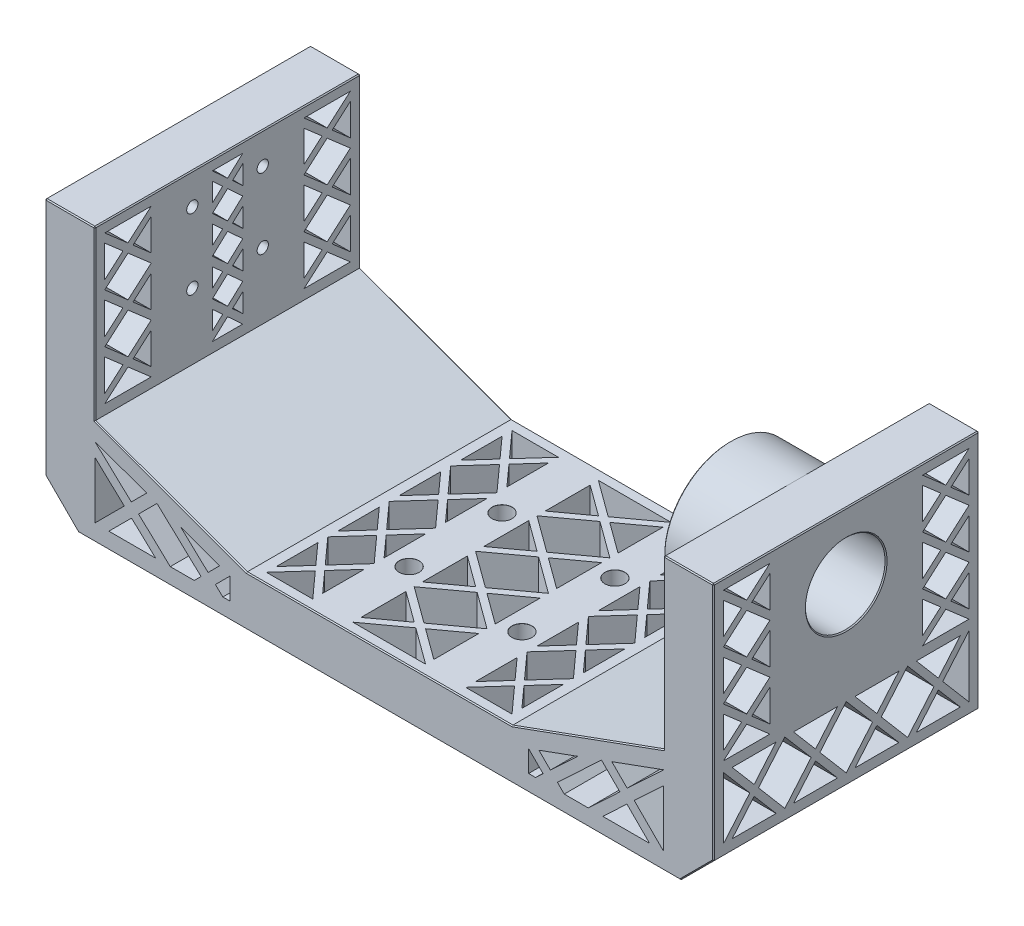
SolidWorks part; units mm, degrees
ref_plane "前视基准面" through (0, 0, 0) normal (0, 0, 1) x (1, 0, 0)
ref_plane "上视基准面" through (0, 0, 0) normal (0, 1, 0) x (1, 0, 0)
ref_plane "右视基准面" through (0, 0, 0) normal (1, 0, 0) x (0, 0, -1)
other "Configuration Table"
sketch "草图1" plane through (0, 0, 0) normal (0, 0, 1) x (1, 0, 0)
  line L0 (40, 0) -> (-40, 0)
  line L1 (-40, 0) -> (-85.7, 16.6334)
  line L2 (-85.7, 16.6334) -> (-85.7, 67.1815)
  line L3 (0, 0) -> (0, 67.1815) construction
  line L4 (85.7, 16.6334) -> (85.7, 67.1815)
  line L5 (40, 0) -> (85.7, 16.6334)
  dimension "D1" = 80
  dimension "D2" = 171.4
  dimension "D3" = 160
extrude "拉伸-薄壁1" add sketch "草图1" along normal mid plane 80 thin
hole_wizard "M3 六角圆柱头螺钉的柱形沉头孔1" positions "草图2" profile "草图3" counterbore size "M3" standard "GB"
sketch "草图2" plane through (0, 0, 0) normal (0, 1, 0) x (1, 0, 0)
  line L1 (17, -14) -> (-17, -14)
  line L2 (17, -14) -> (17, 14)
  line L3 (17, 14) -> (-17, 14)
  line L4 (-17, -14) -> (-17, 14)
  line L5 (17, -14) -> (-17, 14) construction
  line L6 (17, 14) -> (-17, -14) construction
  point P1 (0, 0)
  dimension "D1" = 34
  dimension "D2" = 28
sketch "草图3" plane through (-17, 0, 14) normal (1, 0, 0) x (0, 0, 1)
  line L0 (0, 0) -> (0, 15)
  line L1 (0, 15) -> (1.7, 15)
  line L3 (1.7, 15) -> (1.7, 9)
  line L4 (3, 9) -> (1.7, 9)
  line L5 (3, 9) -> (3, 0.025)
  line L6 (3, 0.025) -> (3.025, 0)
  line L7 (3.025, 0) -> (0, 0)
  line L8 (-3, 0.025) -> (-3.025, 0) construction
  line L11 (0, -6.35) -> (0, 107.95) construction
  dimension "通孔孔直径" = 3.4
  dimension "通孔孔深度" = 15
  dimension "柱形沉头孔直径" = 6
  dimension "柱形沉头孔深度" = 9
  dimension "近端锥形沉头孔直径" = 6.05
  dimension "近端锥形沉头孔角度" = 90
hole_wizard "M3 六角圆柱头螺钉的柱形沉头孔2" positions "草图4" profile "草图5" counterbore size "M3" standard "GB"
sketch "草图4" plane through (-100.7, 0, 0) normal (-1, 0, 0) x (0, 0, 1)
  line L0 (40, 67.1815) -> (-40, 67.1815) construction
  line L2 (10.6066, 36.5749) -> (-10.6066, 36.5749)
  line L3 (10.6066, 36.5749) -> (10.6066, 57.7881)
  line L4 (10.6066, 57.7881) -> (-10.6066, 57.7881)
  line L5 (-10.6066, 36.5749) -> (-10.6066, 57.7881)
  line L6 (10.6066, 36.5749) -> (-10.6066, 57.7881) construction
  line L7 (10.6066, 57.7881) -> (-10.6066, 36.5749) construction
  circle A0 centre (0, 47.1815) radius 15 construction
  dimension "D1" = 30
  dimension "D2" = 20
sketch "草图5" plane through (-100.7, 36.5749, -10.6066) normal (0, 1, 0) x (0, 0, 1)
  line L0 (0, 0) -> (0, 15)
  line L1 (0, 15) -> (1.7, 15)
  line L3 (1.7, 15) -> (1.7, 9)
  line L4 (3, 9) -> (1.7, 9)
  line L5 (3, 9) -> (3, 0.025)
  line L6 (3, 0.025) -> (3.025, 0)
  line L7 (3.025, 0) -> (0, 0)
  line L8 (-3, 0.025) -> (-3.025, 0) construction
  line L11 (0, -6.35) -> (0, 107.95) construction
  dimension "通孔孔直径" = 3.4
  dimension "通孔孔深度" = 15
  dimension "柱形沉头孔直径" = 6
  dimension "柱形沉头孔深度" = 9
  dimension "近端锥形沉头孔直径" = 6.05
  dimension "近端锥形沉头孔角度" = 90
sketch "草图6" plane through (85.7, 0, 0) normal (-1, 0, 0) x (0, 0, 1)
  line L0 (40, 67.1815) -> (-40, 67.1815) construction
  circle A0 centre (0, 47.1815) radius 20
  dimension "D1" = 20
  dimension "D2" = 40
extrude "凸台-拉伸1" add sketch "草图6" along normal blind 20
sketch "草图7" plane through (65.7, 0, 0) normal (-1, 0, 0) x (0, 0, 1)
  circle A0 centre (0, 47.1815) radius 16.25
  dimension "D1" = 32.5
extrude "切除-拉伸1" cut sketch "草图7" against normal blind 7
sketch "草图8" plane through (100.7, 0, 0) normal (1, 0, 0) x (0, 0, -1)
  circle A0 centre (0, 47.1815) radius 12
  dimension "D1" = 24
extrude "切除-拉伸2" cut sketch "草图8" against normal up to next
sketch "草图9" plane through (0, 0, 40) normal (0, 0, 1) x (1, 0, 0)
  line L0 (-100.7, 6.1303) -> (-42.6449, -15)
  line L1 (-42.6449, -15) -> (-100.7, -15)
  line L2 (-100.7, -15) -> (-100.7, 6.1303)
  line L3 (42.6449, -15) -> (100.7, 6.1303)
  line L4 (100.7, 6.1303) -> (100.7, -15)
  line L5 (100.7, -15) -> (42.6449, -15)
extrude "凸台-拉伸2" add sketch "草图9" against normal up to surface (80 mm away)
chamfer "倒角1" distance 10 angle 45 2 edges at (-100.7, -15, 0) (100.7, -15, 0)
chamfer "倒角2" distance 0.3 angle 45 32 edges at (85.7, 67.1815, -20) (65.7, 47.1815, 20) (-100.7, 31.0907, -40) (-93.2, 67.1815, -40) (65.7, 47.1815, 16.25) (-85.7, 41.9075, -40) (100.7, 47.1815, -12) (-62.85, 8.3167, -40) (0, 0, -40) (85.7, 41.9075, 40) (62.85, 8.3167, -40) (85.7, 41.9075, -40) (93.2, 67.1815, -40) (100.7, 31.0907, 40) (0, -15, 40) (95.7, -10, 40) (-95.7, -10, 40) (0, -15, -40) (100.7, 31.0907, -40) (95.7, -10, -40) (-95.7, -10, -40) (62.85, 8.3167, 40) (-100.7, 67.1815, 0) (-85.7, 67.1815, 0) (85.7, 67.1815, 20) (100.7, 67.1815, 0) (0, 0, 40) (-62.85, 8.3167, 40) (-85.7, 41.9075, 40) (-93.2, 67.1815, 40) (-100.7, 31.0907, 40) (93.2, 67.1815, 40)
sketch "草图11" plane through (0, 0, -40) normal (0, 0, -1) x (-1, 0, 0)
  line L0 (-85.7, 11.3126) -> (-45, -3.501)
  line L1 (-45, -3.501) -> (-45, -10)
  line L2 (-45, -10) -> (-85.7, -10)
  line L3 (-85.7, -10) -> (-85.7, 11.3126)
  line L4 (-85.7, 16.6334) -> (-40, 0) construction
  line L5 (90.7, -15) -> (-90.7, -15) construction
  line L7 (-85.7, 66.8815) -> (-85.7, 16.6334) construction
  dimension "D1" = 5
  dimension "D2" = 5
  dimension "D3" = 5
extrude "切除-拉伸4" cut sketch "草图11" against normal up to next
sketch "草图12" plane through (0, 0, -40) normal (0, 0, -1) x (-1, 0, 0)
  line L0 (-85.7, -10) -> (-70.0746, 5.6254)
  line L1 (-45, -3.501) -> (-85.7, 11.3126) construction
  line L3 (-66.9641, 4.4932) -> (-81.4574, -10)
  line L4 (-85.7, -10) -> (-45, -10) construction
  line L5 (-81.4574, -10) -> (-85.7, -10)
  line L6 (-85.7, 11.3126) -> (-85.7, 7.2011)
  line L7 (-85.7, 11.3126) -> (-85.7, -10) construction
  line L8 (-85.7, 7.2011) -> (-67.3454, -10)
  line L10 (-62.9582, -10) -> (-85.7, 11.3126)
  line L11 (-67.3454, -10) -> (-62.9582, -10)
  line L12 (-45, -3.501) -> (-51.499, -10)
  line L16 (-59.7911, 1.8825) -> (-47.1118, -10)
  line L17 (-51.499, -10) -> (-66.9641, 4.4932)
  line L18 (-66.9641, 4.4932) -> (-59.7911, 1.8825)
  line L21 (-70.0746, 5.6254) -> (-59.7911, 1.8825)
  line L22 (-45, -3.501) -> (-48.1105, -2.3689)
  line L23 (-48.1105, -2.3689) -> (-55.7416, -10)
  line L24 (-55.7416, -10) -> (-51.499, -10)
  line L25 (-47.1118, -10) -> (-51.499, -10)
  point P17 (-58.7685, -10)
  point P24 (-67.2593, 4.6007)
  point P25 (-56.128, -10.0626)
  dimension "D1" = 3
  dimension "D2" = 3
  dimension "D3" = 3
  dimension "D4" = 45
  dimension "D5" = 3
extrude "凸台-拉伸3" add sketch "草图12" against normal up to surface (80 mm away) contours L10 L3 L0 M14 | L3 L10 L0 L8 | L0 L10 L8 M13 | L8 L0 L3 M16 | L10 L3 L8 M16 | L23 L16 L17 M14 | L23 L16 L12 M14 | L16 L23 L17 L12 | L17 L23 M16 | L16 L12 M16
mirror "镜向1" about plane through (0, 0, 0) normal (1, 0, 0) of "切除-拉伸4", "凸台-拉伸3"
sketch "草图14" plane through (-85.7, 0, 0) normal (1, 0, 0) x (0, 0, -1)
  line L0 (39.7, 67.1815) -> (-39.7, 67.1815) construction
  line L1 (23, 19.6334) -> (37, 19.6334)
  line L2 (23, 19.6334) -> (23, 64.1815)
  line L3 (23, 64.1815) -> (37, 64.1815)
  line L4 (37, 19.6334) -> (37, 64.1815)
  line L5 (23, 19.6334) -> (37, 64.1815) construction
  line L6 (23, 64.1815) -> (37, 19.6334) construction
  line L7 (40, -4.8757) -> (40, 66.8815) construction
  line L8 (-39.7, 16.6334) -> (39.7, 16.6334) construction
  circle A1 centre (0, 47.1815) radius 20 construction
  point P0 (30, 41.9075)
  dimension "D1" = 3
  dimension "D2" = 3
  dimension "D3" = 3
  dimension "D4" = 3
extrude "切除-拉伸5" cut sketch "草图14" against normal blind 15
sketch "草图15" plane through (-100.7, 0, 0) normal (-1, 0, 0) x (0, 0, 1)
  line L1 (-37, 34.4828) -> (-37, 31.8302)
  line L4 (-37, 31.8302) -> (-23, 19.6334)
  line L8 (-23, 19.6334) -> (-23, 22.286)
  line L28 (-23, 19.6334) -> (-23, 64.1815) construction
  line L32 (-37, 49.3321) -> (-23, 61.5289)
  line L35 (-37, 64.1815) -> (-37, 19.6334) construction
  line L55 (-37, 49.3321) -> (-37, 46.6796)
  line L56 (-37, 46.6796) -> (-23, 34.4828)
  line L57 (-23, 34.4828) -> (-23, 37.1353)
  line L58 (-23, 37.1353) -> (-37, 49.3321)
  line L59 (-23, 49.3321) -> (-23, 46.6796)
  line L60 (-23, 46.6796) -> (-37, 34.4828)
  line L61 (-37, 34.4828) -> (-37, 37.1353)
  line L62 (-37, 37.1353) -> (-23, 49.3321)
  line L63 (-23, 22.286) -> (-37, 34.4828)
  line L64 (-23, 34.4828) -> (-37, 22.286)
  line L65 (-37, 22.286) -> (-37, 19.6334)
  line L66 (-37, 19.6334) -> (-23, 31.8302)
  line L67 (-23, 31.8302) -> (-23, 34.4828)
  line L68 (-23, 61.5289) -> (-23, 64.1815)
  line L69 (-23, 64.1815) -> (-37, 51.9847)
  line L70 (-37, 51.9847) -> (-37, 49.3321)
  line L71 (-23, 49.3321) -> (-37, 61.5289)
  line L72 (-37, 61.5289) -> (-37, 64.1815)
  line L73 (-37, 64.1815) -> (-23, 51.9847)
  line L74 (-23, 51.9847) -> (-23, 49.3321)
  point P7 (-23, 30.8308)
  point P16 (-37, 62.6154)
  point P27 (-37, 61.5289)
  point P28 (-23, 58.7965)
  dimension "D1" = 2
  dimension "D2" = 2
  dimension "D3" = 2
  dimension "D4" = 2
  dimension "D5" = 2
extrude "凸台-拉伸4" add sketch "草图15" against normal blind 15 contours L73 L71 L69 M31 | L73 L69 L71 L32 | L69 L73 L32 M33 | L32 L71 L69 M31 | L73 L32 L71 M33 | L62 L58 L60 M33 | L56 L62 L58 M31 | L62 L56 L60 L58 | L62 L60 L56 M31 | L58 L60 L56 M33 | L63 L66 L64 M33 | L64 L63 L4 M31 | L4 L66 L63 L64 | L66 L4 L63 M33 | L66 L4 L64 M31
mirror "镜向5" about plane through (0, 0, 0) normal (1, 0, 0) of "切除-拉伸5", "凸台-拉伸4"
sketch "草图16" plane through (-100.7, 0, 0) normal (-1, 0, 0) x (0, 0, 1)
  line L0 (-39.7, 67.1815) -> (39.7, 67.1815) construction
  line L1 (4.5816, 19.6334) -> (-4.5816, 19.6334)
  line L2 (4.5816, 19.6334) -> (4.5816, 64.1815)
  line L3 (4.5816, 64.1815) -> (-4.5816, 64.1815)
  line L4 (-4.5816, 19.6334) -> (-4.5816, 64.1815)
  line L5 (4.5816, 19.6334) -> (-4.5816, 64.1815) construction
  line L6 (4.5816, 64.1815) -> (-4.5816, 19.6334) construction
  line L7 (39.7, 16.6334) -> (-39.7, 16.6334) construction
  circle A1 centre (10.6066, 57.7881) radius 3.025 construction
  circle A2 centre (-10.6066, 57.7881) radius 3.025 construction
  point P0 (0, 41.9075)
  point P5 (0, 44.013)
  dimension "D1" = 3
  dimension "D2" = 3
  dimension "D3" = 3
  dimension "D4" = 3
extrude "切除-拉伸6" cut sketch "草图16" against normal up to next
sketch "草图17" plane through (-100.7, 0, 0) normal (-1, 0, 0) x (0, 0, 1)
  line L34 (-4.5816, 64.1815) -> (-4.5816, 61.4652)
  line L35 (-4.5816, 64.1815) -> (-4.5816, 19.6334) construction
  line L36 (-4.5816, 61.4652) -> (4.5816, 53.0445)
  line L37 (4.5816, 19.6334) -> (4.5816, 64.1815) construction
  line L38 (4.5816, 53.0445) -> (4.5816, 55.7607)
  line L39 (4.5816, 55.7607) -> (-4.5816, 64.1815)
  line L40 (4.5816, 64.1815) -> (4.5816, 61.4652)
  line L41 (4.5816, 61.4652) -> (-4.5816, 53.0445)
  line L42 (-4.5816, 53.0445) -> (-4.5816, 55.7607)
  line L43 (-4.5816, 55.7607) -> (4.5816, 64.1815)
  line L44 (-4.5816, 53.0445) -> (4.5816, 44.6237)
  line L45 (4.5816, 44.6237) -> (4.5816, 41.9075)
  line L46 (4.5816, 41.9075) -> (-4.5816, 50.3282)
  line L47 (-4.5816, 50.3282) -> (-4.5816, 53.0445)
  line L48 (4.5816, 53.0445) -> (-4.5816, 44.6237)
  line L49 (-4.5816, 44.6237) -> (-4.5816, 41.9075)
  line L50 (-4.5816, 41.9075) -> (4.5816, 50.3282)
  line L51 (4.5816, 50.3282) -> (4.5816, 53.0445)
  line L52 (-4.5816, 41.9075) -> (4.5816, 33.4867)
  line L53 (4.5816, 33.4867) -> (4.5816, 30.7704)
  line L54 (4.5816, 30.7704) -> (-4.5816, 39.1912)
  line L55 (-4.5816, 39.1912) -> (-4.5816, 41.9075)
  line L56 (4.5816, 41.9075) -> (-4.5816, 33.4867)
  line L57 (-4.5816, 33.4867) -> (-4.5816, 30.7704)
  line L58 (-4.5816, 30.7704) -> (4.5816, 39.1912)
  line L59 (4.5816, 39.1912) -> (4.5816, 41.9075)
  line L60 (-4.5816, 30.7704) -> (4.5816, 22.3497)
  line L61 (4.5816, 22.3497) -> (4.5816, 19.6334)
  line L62 (4.5816, 19.6334) -> (-4.5816, 28.0542)
  line L63 (-4.5816, 28.0542) -> (-4.5816, 30.7704)
  line L64 (4.5816, 30.7704) -> (-4.5816, 22.3497)
  line L65 (-4.5816, 22.3497) -> (-4.5816, 19.6334)
  line L66 (-4.5816, 19.6334) -> (4.5816, 28.0542)
  line L67 (4.5816, 28.0542) -> (4.5816, 30.7704)
  point P12 (-4.5816, 24.5438)
  point P35 (-4.5816, 29.9561)
  point P36 (-4.5816, 23.0884)
  point P37 (4.5816, 44.6237)
  dimension "D1" = 2
  dimension "D2" = 2
  dimension "D3" = 2
  dimension "D4" = 2
  dimension "D5" = 2
  dimension "D6" = 2
  dimension "D7" = 2
extrude "凸台-拉伸5" add sketch "草图17" against normal blind 15 contours L66 L62 L61 L60 | L65 L66 L62 L64 | L62 L66 L60 L64 | L64 L60 L63 L62 | L66 L67 L64 L60 | L57 L58 L54 L56 | L58 L54 L53 L52 | L54 L58 L52 L56 | L56 L52 L55 L54 | L58 L59 L56 L52 | L49 L50 L46 L48 | L46 L50 L44 L48 | L50 L46 L45 L44 | L50 L51 L48 L44 | L48 L44 L47 L46 | L39 L41 L36 L38 | L43 L36 L41 L39 | L43 L42 L41 L36 | L36 L43 L39 L34 | L43 L39 L41 L40
sketch "草图18" plane through (0, 0, 0) normal (0, 1, 0) x (1, 0, 0)
  line L0 (-40.0529, 40) -> (40.0529, 40) construction
  line L1 (10.975, -37) -> (-10.975, -37)
  line L2 (10.975, -37) -> (10.975, 37)
  line L3 (10.975, 37) -> (-10.975, 37)
  line L4 (-10.975, -37) -> (-10.975, 37)
  line L5 (10.975, -37) -> (-10.975, 37) construction
  line L6 (10.975, 37) -> (-10.975, -37) construction
  circle A5 centre (-17, 14) radius 3.025 construction
  point P0 (0, 0)
  dimension "D1" = 3
  dimension "D2" = 3
extrude "切除-拉伸7" cut sketch "草图18" against normal up to next
sketch "草图19" plane through (0, 0, 0) normal (0, 1, 0) x (1, 0, 0)
  line L0 (-10.975, 37) -> (-10.975, 34.5238)
  line L1 (-10.975, 37) -> (-10.975, -37) construction
  line L2 (-10.975, 34.5238) -> (10.975, 18.5)
  line L3 (10.975, -37) -> (10.975, 37) construction
  line L4 (10.975, 18.5) -> (10.975, 20.9762)
  line L5 (10.975, 20.9762) -> (-10.975, 37)
  line L6 (10.975, 37) -> (10.975, 34.5238)
  line L7 (10.975, 34.5238) -> (-10.975, 18.5)
  line L8 (-10.975, 18.5) -> (-10.975, 20.9762)
  line L9 (-10.975, 20.9762) -> (10.975, 37)
  line L10 (-10.975, 18.5) -> (-10.975, 16.0238)
  line L11 (-10.975, 16.0238) -> (10.975, 0)
  line L12 (10.975, 0) -> (10.975, 2.4762)
  line L13 (10.975, 2.4762) -> (-10.975, 18.5)
  line L14 (10.975, 18.5) -> (10.975, 16.0238)
  line L15 (10.975, 16.0238) -> (-10.975, 0)
  line L16 (-10.975, 0) -> (-10.975, 2.4762)
  line L17 (-10.975, 2.4762) -> (10.975, 18.5)
  point P12 (0, 0)
  dimension "D1" = 2
  dimension "D2" = 2
  dimension "D3" = 2
  dimension "D4" = 2
extrude "凸台-拉伸6" add sketch "草图19" against normal up to surface (15 mm away) contours L9 L5 L7 M11 | L9 L7 L2 M9 | L11 L17 L13 M9 | L17 L13 L15 M11 | L17 L11 L15 L13 | L17 L15 L11 M9 | L13 L15 L11 M11 | L5 L7 L2 M11 | L9 L2 L7 L5 | L2 L9 L5 M9
mirror "镜向8" about plane through (0, 0, 0) normal (0, 0, 1) of "凸台-拉伸6"
sketch "草图20" plane through (0, 0, 0) normal (0, 1, 0) x (1, 0, 0)
  line L0 (-40.0529, 40) -> (40.0529, 40) construction
  line L1 (-23.025, -37) -> (-37, -37)
  line L2 (-23.025, -37) -> (-23.025, 37)
  line L3 (-23.025, 37) -> (-37, 37)
  line L4 (-37, -37) -> (-37, 37)
  line L5 (-23.025, -37) -> (-37, 37) construction
  line L6 (-23.025, 37) -> (-37, -37) construction
  line L7 (-40, -39.7) -> (-40, 39.7) construction
  circle A1 centre (-17, 14) radius 3.025 construction
  point P0 (-30.0125, 0)
  point P5 (0, 0)
  dimension "D1" = 3
  dimension "D2" = 3
  dimension "D3" = 3
extrude "切除-拉伸8" cut sketch "草图20" against normal up to next
sketch "草图21" plane through (0, 0, 0) normal (0, 1, 0) x (1, 0, 0)
  line L0 (-37, 37) -> (-37, 34.012)
  line L1 (-37, 37) -> (-37, -37) construction
  line L2 (-37, 34.012) -> (-23.025, 18.5)
  line L3 (-23.025, -37) -> (-23.025, 37) construction
  line L4 (-23.025, 18.5) -> (-23.025, 21.488)
  line L5 (-23.025, 21.488) -> (-37, 37)
  line L6 (-23.025, 37) -> (-23.025, 34.012)
  line L7 (-23.025, 34.012) -> (-37, 18.5)
  line L8 (-37, 18.5) -> (-37, 21.488)
  line L9 (-37, 21.488) -> (-23.025, 37)
  line L10 (-37, 18.5) -> (-37, 15.512)
  line L11 (-37, 15.512) -> (-23.025, 0)
  line L12 (-23.025, 0) -> (-23.025, 2.988)
  line L13 (-23.025, 2.988) -> (-37, 18.5)
  line L14 (-23.025, 18.5) -> (-23.025, 15.512)
  line L15 (-23.025, 15.512) -> (-37, 0)
  line L16 (-37, 0) -> (-37, 2.988)
  line L17 (-37, 2.988) -> (-23.025, 18.5)
  point P17 (-23.025, 2.295)
  dimension "D1" = 2
  dimension "D2" = 2
  dimension "D3" = 2
  dimension "D4" = 2
extrude "凸台-拉伸7" add sketch "草图21" against normal up to surface (15 mm away) contours L2 L9 L5 L0 | L9 L2 L7 L5 | L9 L5 L7 L6 | L5 L7 L2 L4 | L9 L8 L7 L2 | L11 L17 L13 L10 | L17 L11 L15 L13 | L17 L13 L15 L14 | L13 L15 L11 L12 | L17 L16 L15 L11
mirror "镜向9" about plane through (0, 0, 0) normal (0, 0, 1) of "凸台-拉伸7"
mirror "镜向10" about plane through (0, 0, 0) normal (1, 0, 0) of "镜向9", "切除-拉伸8", "凸台-拉伸7"
sketch "草图22" plane through (100.7, 0, 0) normal (1, 0, 0) x (0, 0, -1)
  line L0 (40, 66.8815) -> (40, -4.8757) construction
  line L1 (37, -2) -> (-37, -2)
  line L2 (37, -2) -> (37, 16.6334)
  line L3 (37, 16.6334) -> (-37, 16.6334)
  line L4 (-37, -2) -> (-37, 16.6334)
  line L5 (37, -2) -> (-37, 16.6334) construction
  line L6 (37, 16.6334) -> (-37, -2) construction
  line L7 (-39.7, -5) -> (39.7, -5) construction
  line L8 (23, 19.6334) -> (37, 19.6334) construction
  point P0 (0, 7.3167)
  point P5 (0, 0)
  dimension "D1" = 3
  dimension "D2" = 3
  dimension "D3" = 3
extrude "切除-拉伸9" cut sketch "草图22" against normal blind 10
sketch "草图23" plane through (90.7, 0, 0) normal (1, 0, 0) x (0, 0, -1)
  line L1 (37, 16.6334) -> (-37, 16.6334) construction
  line L2 (-34.3727, 16.6334) -> (-18.5, -2)
  line L3 (-37, -2) -> (37, -2) construction
  line L4 (-18.5, -2) -> (-21.1273, -2)
  line L5 (-21.1273, -2) -> (-37, 16.6334)
  line L6 (-37, 16.6334) -> (-37, -2) construction
  line L7 (-37, 16.6334) -> (-34.3727, 16.6334)
  line L8 (-37, -2) -> (-34.3727, -2)
  line L9 (-34.3727, -2) -> (-18.5, 16.6334)
  line L10 (-18.5, 16.6334) -> (-21.1273, 16.6334)
  line L11 (37, 16.6334) -> (-37, 16.6334) construction
  line L12 (-21.1273, 16.6334) -> (-37, -2)
  line L13 (-18.5, 16.6334) -> (-15.8727, 16.6334)
  line L14 (-15.8727, 16.6334) -> (0, -2)
  line L15 (-37, -2) -> (37, -2) construction
  line L16 (0, -2) -> (-2.6273, -2)
  line L17 (-2.6273, -2) -> (-18.5, 16.6334)
  line L18 (-18.5, -2) -> (-15.8727, -2)
  line L19 (-15.8727, -2) -> (0, 16.6334)
  line L20 (0, 16.6334) -> (-2.6273, 16.6334)
  line L21 (-2.6273, 16.6334) -> (-18.5, -2)
  point P13 (-15.8606, 16.6334)
  dimension "D1" = 2
  dimension "D2" = 2
  dimension "D3" = 2
extrude "凸台-拉伸8" add sketch "草图23" along normal blind 10 contours L12 L2 L5 M11 | L2 L12 L5 L9 | L5 L12 L9 M9 | L9 L5 L2 M9 | L12 L2 L9 M11 | L21 L14 L17 M11 | L14 L21 L17 L19 | L21 L14 L19 M11 | L19 L17 L14 M9 | L17 L21 L19 M9
mirror "镜向11" about plane through (0, 0, 0) normal (0, 0, 1) of "凸台-拉伸8"
mirror "镜向12" about plane through (0, 0, 0) normal (1, 0, 0) of "凸台-拉伸8", "切除-拉伸9", "镜向11"
